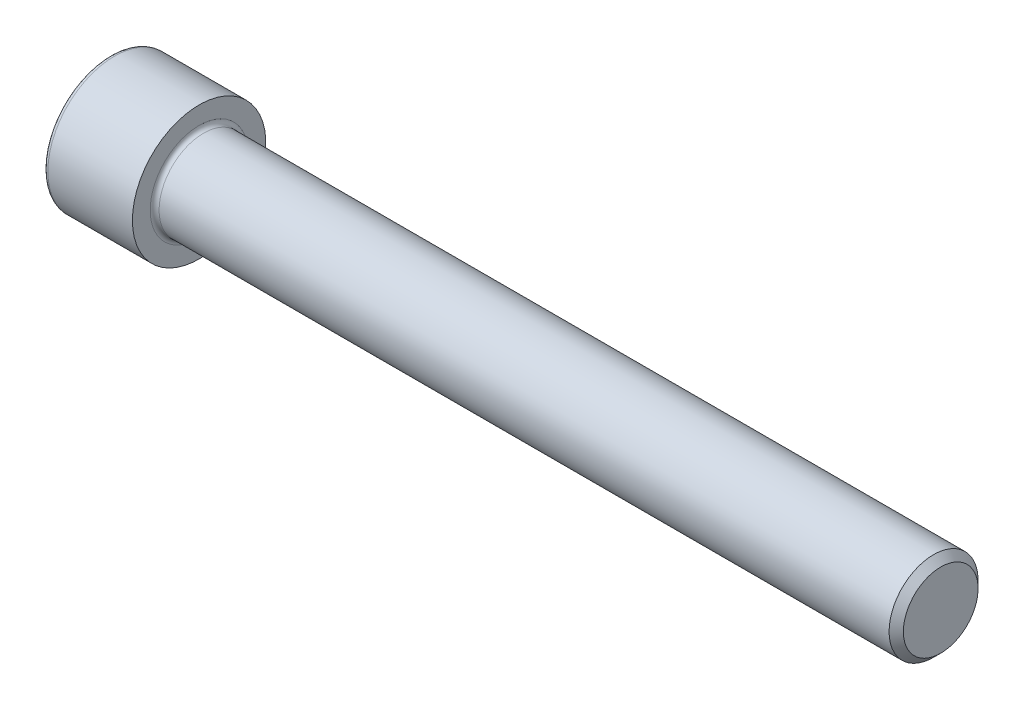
SolidWorks part; units mm, degrees
ref_plane "Plane1" through (0, 0, 0) normal (0, 0, 1) x (1, 0, 0)
ref_plane "Plane2" through (0, 0, 0) normal (0, 1, 0) x (1, 0, 0)
ref_plane "Plane3" through (0, 0, 0) normal (1, 0, 0) x (0, 0, -1)
sketch "BodySke" plane through (0, 0, 0) normal (0, 0, 1) x (1, 0, 0)
  line L0 (0, 0) -> (0, 9)
  line L1 (0, 9) -> (12, 9)
  line L2 (12, 9) -> (12, 6)
  line L3 (12, 6) -> (111.036, 6)
  line L4 (112, 5.036) -> (112, 0)
  line L5 (112, 0) -> (0, 0)
  line L6 (-31.75, 0) -> (127, 0) construction
  line L8 (112, 5.036) -> (111.036, 6)
  line L10 (112, -5.036) -> (111.036, -6) construction
  line L11 (13.75, 9.525) -> (13.75, 3.175) construction
  line L12 (12, 9.525) -> (12, 3.175) construction
  line L13 (52, 9.525) -> (52, 3.175) construction
  dimension "Diameter" = 12
  dimension "Head_ht" = 12
  dimension "Length" = 100
  dimension "Body_ch_ang" = 45
  dimension "Head_dia" = 18
  dimension "Minor_dia" = 10.072
  dimension "Advance" = 1.75
  dimension "Thread_nom" = 100
  dimension "Thread_length" = 60
revolve "Base-Revolve" add sketch "BodySke"
fillet "Fillet1" radius 0.6 1 edges at (12, 0, 6)
fillet "Fillet2" radius 0.6 1 edges at (0, 0, 9)
sketch "Sketch2" plane through (0, 0, 0) normal (0, 0, 1) x (1, 0, 0)
  line L0 (0, 5.0575) -> (6, 5.0575)
  line L1 (6, 5.0575) -> (8.9199, 0)
  line L2 (-31.75, 0) -> (127, 0) construction
  line L3 (8.9199, 0) -> (0, 0)
  line L4 (0, 0) -> (0, 5.0575)
  line L6 (0, 0) -> (47.625, 0) construction
  dimension "D1" = 5.0575
  dimension "D2" = 60
  dimension "Depth" = 6
revolve "Hex-PreBroach" cut sketch "Sketch2" angle 360 about L6
sketch "Sketch3" plane through (0, 0, 0) normal (-1, 0, 0) x (0, 0.5, 0.866)
  line L0 (2.9199, 5.0575) -> (-2.9199, 5.0575)
  line L1 (-2.9199, 5.0575) -> (-5.8399, 0)
  line L2 (2.9199, 5.0575) -> (5.8399, 0)
  line L3 (2.9199, -5.0575) -> (5.8399, 0)
  line L4 (2.9199, -5.0575) -> (-2.9199, -5.0575)
  line L5 (-2.9199, -5.0575) -> (-5.8399, 0)
  dimension "D1" = 5.0575
  dimension "D2" = 5.0575
  dimension "Hex_size" = 10.115
extrude "Hex" cut sketch "Sketch3" against normal blind 6
sketch "ThdSchSke" plane through (0, 0, 0) normal (0, 0, 1) x (1, 0, 0)
  line L0 (17.25, -5.036) -> (16.575, -6)
  line L1 (17.25, -5.036) -> (17.925, -6)
  line L2 (17.925, -6) -> (17.925, -7.5)
  line L3 (-3.175, 0) -> (5.1513, 0) construction
  line L4 (0, 8.4) -> (0, -8.4) construction
  line L5 (17.925, -7.5) -> (16.575, -7.5)
  line L6 (16.575, -7.5) -> (16.575, -6)
  dimension "Thread_minor" = 10.072
  dimension "Diameter" = 12
  dimension "Start" = 17.25
  dimension "SideAngle" = 55
  dimension "VeeAngle" = 70
  dimension "Overcut" = 15
revolve "ThreadSchematic" [suppressed] cut sketch "ThdSchSke" angle 360 about L3
pattern_linear "ThdSchPat" [suppressed]
equation "\"D2@Sketch3\" = \"Hex_size@Sketch3\" / 2"
equation "\"D1@Sketch3\" = \"Hex_size@Sketch3\" / 2"
equation "\"D1@Sketch2\" = \"Hex_size@Sketch3\" / 2"
equation "\"Thread_minor@ThreadCosmetic\"  =  \"Minor_dia@BodySke\""
equation "\"Depth@Sketch2\" =  \"Key_eng@Hex\""
equation "\"Thread_length@ThreadCosmetic\" = ((sgn( (\"Length@BodySke\" - \"Advance@BodySke\" * 3.0) - \"Thread_nom@BodySke\" )-1)*( (\"Length@BodySke\" - \"Advance@BodySke\" * 3.0) - \"Thread_nom@BodySke\" ))/-2+ \"Thread_no"
equation "\"Thread_minor@ThdSchSke\" = \"Minor_dia@BodySke\""
equation "\"Diameter@ThdSchSke\" = \"Diameter@BodySke\""
equation "\"Overcut@ThdSchSke\" = \"Diameter@BodySke\" * 1.25"
equation "\"Start@ThdSchSke\" = \"Head_ht@BodySke\" + \"Length@BodySke\" - \"Thread_length@ThreadCosmetic\"  '---Non-countersunk---"
equation "\"Num_threads@ThdSchPat\" = int( \"Thread_length@ThreadCosmetic\" / \"Advance@BodySke\" + 0.999 )  + 1"
equation "\"Advance@ThdSchPat\" = \"Thread_length@ThreadCosmetic\" /  (\"Num_threads@ThdSchPat\" - 1) 'relax it"
equation "\"Num_threads@ThdSchPat\" = \"Num_threads@ThdSchPat\" - sgn( \"Num_threads@ThdSchPat\" - 1) '---chamfered tips only---"
